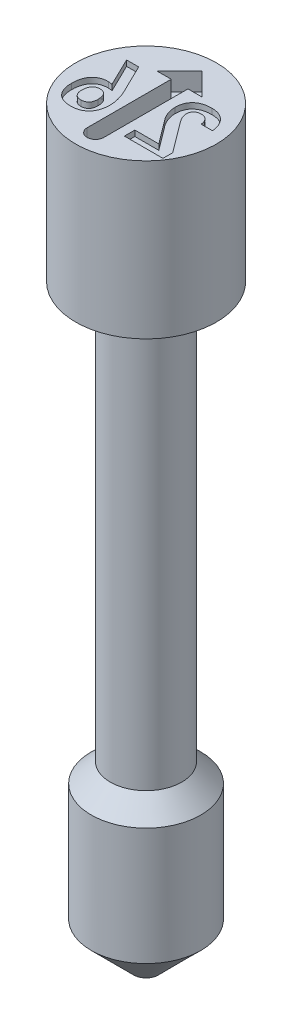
SolidWorks part; units mm, degrees
ref_plane "Front Plane" through (0, 0, 0) normal (0, 0, 1) x (1, 0, 0)
ref_plane "Top Plane" through (0, 0, 0) normal (0, 1, 0) x (1, 0, 0)
ref_plane "Right Plane" through (0, 0, 0) normal (1, 0, 0) x (0, 0, -1)
sketch "Sketch1" plane through (0, 0, 0) normal (0, 0, 1) x (1, 0, 0)
  line L0 (0, 17.018) -> (1.6002, 17.018)
  line L1 (0, -1.7602) -> (0, 1.7602) construction
  line L2 (1.6002, 17.018) -> (1.6002, 13.5128)
  line L3 (1.6002, 13.5128) -> (0.8128, 13.5128)
  line L4 (0.8128, 13.5128) -> (0.8128, 4.064)
  line L5 (0.8128, 4.064) -> (1.2446, 3.6322)
  line L6 (1.2446, 3.6322) -> (1.2446, 0.9652)
  line L7 (1.2446, 0.9652) -> (0.2794, 0)
  line L8 (1.7602, 0) -> (-1.7602, 0) construction
  line L9 (0.2794, 0) -> (0, 0)
  line L10 (0, 0) -> (0, 17.018)
  line L11 (0, 0) -> (0, 64.9194) construction
  dimension "D1" = 17.018
  dimension "D2" = 4.064
  dimension "D3" = 0.9652
  dimension "D4" = 45
  dimension "D5" = 2.4892
  dimension "D6" = 3.2004
  dimension "D7" = 1.6256
  dimension "D8" = 3.5052
revolve "Revolve1" add sketch "Sketch1" angle 360 about L11
sketch "Sketch2" plane through (0, 17.018, 0) normal (0, 1, 0) x (1, 0, 0)
  line L1 (0.1905, -1.1492) -> (0.1905, 0.762)
  line L2 (-0.1905, -1.1492) -> (-0.1905, 0.762)
  line L3 (0, -1.7602) -> (0, 1.7602) construction
  line L4 (-0.1905, 0.762) -> (-0.508, 0.762)
  line L5 (0.1905, 0.762) -> (0.508, 0.762)
  line L6 (0.508, 0.762) -> (0, 1.27)
  line L7 (0, 1.27) -> (-0.508, 0.762)
  line L8 (-1.7602, 0) -> (1.7602, 0) construction
  arc A0 (-0.1905, -1.1492) -> (0.1905, -1.1492) centre (0, -1.1492) ccw
  dimension "D6" = 1.1492
  dimension "D1" = 0.381
  dimension "D2" = 0.1905
  dimension "D3" = 1.016
  dimension "D4" = 0.508
  dimension "D5" = 45
  dimension "D7" = 0.762
extrude "Cut-Extrude1" cut sketch "Sketch2" against normal blind 0.4064
sketch "Sketch3" plane through (0, 17.018, 0) normal (0, 1, 0) x (1, 0, 0)
  text T0 "2 6" font "Bahnschrift SemiBold" height 1.524
  dimension "D1" = 0.889
extrude "Cut-Extrude2" cut sketch "Sketch3" against normal blind 0.127
